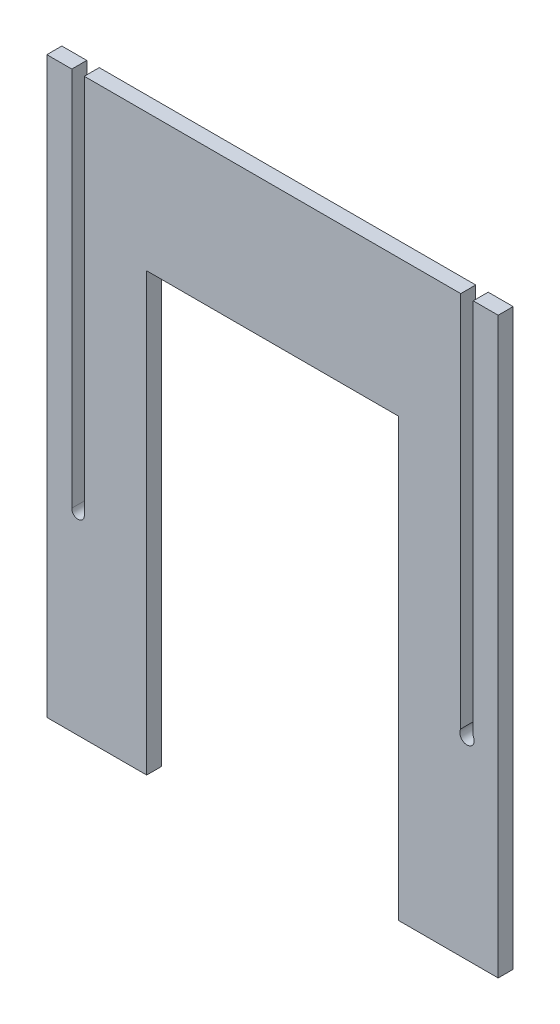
SolidWorks part; units mm, degrees
ref_plane "Front Plane" through (0, 0, 0) normal (0, 0, 1) x (1, 0, 0)
ref_plane "Top Plane" through (0, 0, 0) normal (0, 1, 0) x (1, 0, 0)
ref_plane "Right Plane" through (0, 0, 0) normal (1, 0, 0) x (0, 0, -1)
sketch "Sketch1" plane through (0, 0, 0) normal (0, 0, 1) x (1, 0, 0)
  line L0 (-46.1866, 26.1754) -> (255.4914, 26.1754)
  line L1 (-56.1866, 26.1754) -> (-76.1866, 26.1754)
  line L2 (265.4914, 26.1754) -> (285.4914, 26.1754)
  line L3 (-76.1866, 26.1754) -> (-76.1866, -433.8246)
  line L4 (-76.1866, -433.8246) -> (3.8134, -433.8246)
  line L5 (285.4914, 26.1754) -> (285.4914, -433.8246)
  line L6 (285.4914, -433.8246) -> (205.4914, -433.8246)
  line L7 (3.8134, -433.8246) -> (3.8134, -83.8246)
  line L8 (205.4914, -433.8246) -> (205.4914, -83.8246)
  line L9 (3.8134, -83.8246) -> (205.4914, -83.8246)
  line L10 (-56.1866, 26.1754) -> (-56.1866, -278.8246)
  line L11 (-56.1866, 26.1754) -> (-46.1866, 26.1754)
  line L12 (-46.1866, 26.1754) -> (-46.1866, -278.8246)
  line L13 (-56.1866, -278.8246) -> (-56.0974, -278.8246)
  line L14 (-46.2759, -278.8246) -> (-46.1866, -278.8246)
  line L15 (265.4914, 26.1754) -> (265.4914, -278.8246)
  line L16 (255.4914, 26.1754) -> (255.4914, -278.8246)
  line L17 (255.4914, 26.1754) -> (265.4914, 26.1754)
  line L18 (-56.1866, -278.8246) -> (-56.0974, -278.8246)
  line L20 (-46.2759, -278.8246) -> (-46.1866, -278.8246)
  arc A0 (-56.1866, -278.5573) -> (-46.1866, -278.5573) centre (-51.1866, -278.8246) ccw
  arc A1 (255.4914, -275.9551) -> (265.4914, -275.9551) centre (260.4914, -278.8246) ccw
  dimension "D1" = 10
extrude "Boss-Extrude2" add sketch "Sketch1" along normal blind 12 contours A1 L16 L0 L12 A0 L10 L1 L3 L4 L7 L9 L8 L6 L5 L2 L15
